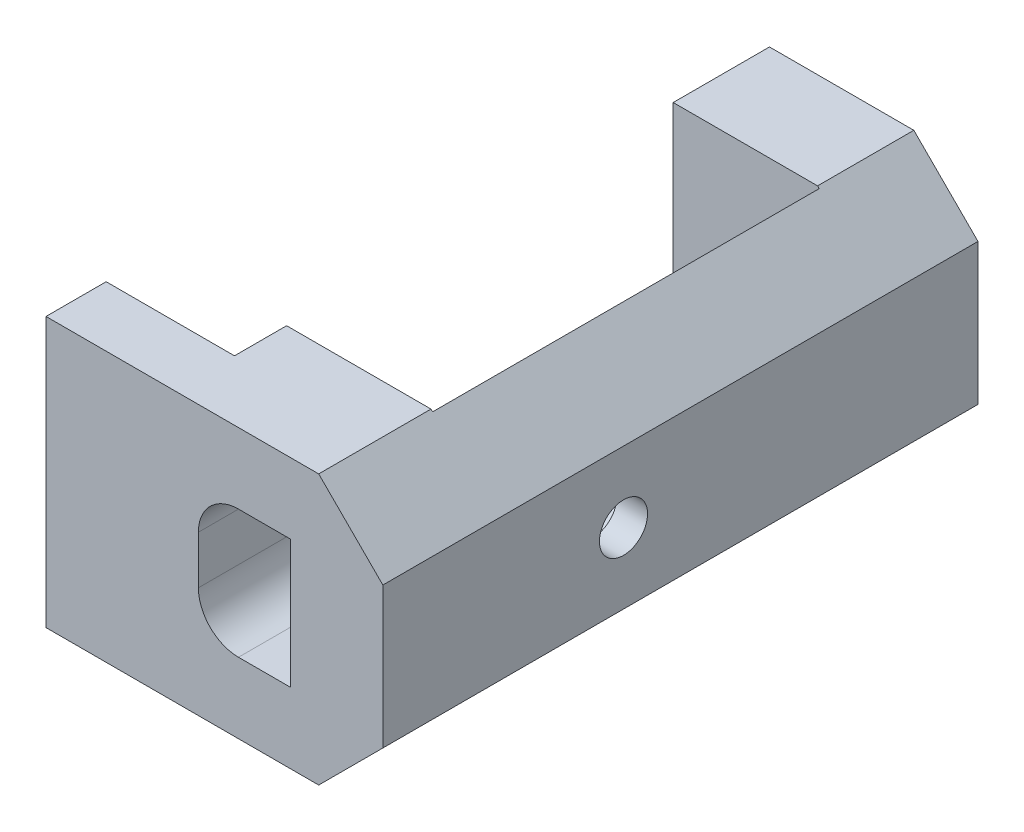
SolidWorks part; units mm, degrees
ref_plane "Front" through (0, 0, 0) normal (0, 0, 1) x (1, 0, 0)
ref_plane "Top" through (0, 0, 0) normal (0, 1, 0) x (1, 0, 0)
ref_plane "Right" through (0, 0, 0) normal (1, 0, 0) x (0, 0, -1)
sketch "Sketch1" plane through (0, 0, 0) normal (0, 1, 0) x (1, 0, 0)
  line L0 (0, 0) -> (13, 0)
  line L1 (13, 0) -> (13, 33.1)
  line L2 (0, 0) -> (0, 5)
  line L3 (0, 5) -> (9.1, 5)
  line L4 (9.1, 5) -> (9.1, 28.1)
  line L5 (13, 16.55) -> (-7.0543, 16.55) construction
  line L6 (0, 28.1) -> (9.1, 28.1)
  line L7 (0, 33.1) -> (0, 28.1)
  line L8 (0, 33.1) -> (13, 33.1)
  point P12 (9.1, 16.55)
  dimension "D1" = 5
  dimension "D2" = 13
  dimension "D3" = 9.1
  dimension "D4" = 16.55
extrude "Boss-Extrude1" add sketch "Sketch1" along normal blind 16.8
sketch "Sketch3" plane through (13, 0, 0) normal (1, 0, 0) x (0, 0, -1)
  line L0 (0, 8.4) -> (33.1, 8.4) construction
  line L1 (0, 16.8) -> (0, 0) construction
  line L2 (33.1, 16.8) -> (33.1, 0) construction
  circle A0 centre (12, 8.4) radius 1.5
  dimension "D1" = 3
  dimension "D2" = 12
extrude "Cut-Extrude2" cut sketch "Sketch3" against normal blind 10
sketch "Sketch5" plane through (9.1, 0, 0) normal (-1, 0, 0) x (0, 0, 1)
  line L1 (-11.9118, 11.3987) -> (-14.5528, 9.9758)
  line L2 (-14.5528, 9.9758) -> (-14.6411, 6.9771)
  line L3 (-14.6411, 6.9771) -> (-12.0882, 5.4013)
  line L4 (-12.0882, 5.4013) -> (-9.4472, 6.8242)
  line L5 (-9.4472, 6.8242) -> (-9.3589, 9.8229)
  line L6 (-9.3589, 9.8229) -> (-11.9118, 11.3987)
  circle A0 centre (-12, 8.4) radius 2.5981 construction
  dimension "D1" = 6
extrude "Cut-Extrude4" cut sketch "Sketch5" against normal blind 2
chamfer "Chamfer1" distance 4 angle 45 2 edges at (13, 16.8, -16.55) (13, 0, -16.55)
sketch "Sketch7" plane through (0, 0, 0) normal (0, 0, 1) x (1, 0, 0)
  line L0 (0, 0) -> (9, 0)
  line L1 (9, 0) -> (13, 4)
  line L2 (13, 4) -> (13, 12.8)
  line L3 (13, 12.8) -> (9, 16.8)
  line L4 (9, 16.8) -> (0, 16.8)
  line L5 (0, 16.8) -> (0, 0)
extrude "Boss-Extrude2" add sketch "Sketch7" along normal blind 3
sketch "Sketch6" plane through (0, 0, 0) normal (-1, 0, 0) x (0, 0, 1)
  line L0 (-5, 16.8) -> (3, 16.8) construction
  line L1 (-5, 0) -> (-0.75, 0)
  line L2 (-5, 0) -> (-5, 16.8)
  line L3 (-5, 16.8) -> (-0.75, 16.8)
  line L4 (-0.75, 0) -> (-0.75, 16.8)
  line L9 (-0.75, 0) -> (-0.75, 16.8)
  line L10 (-0.75, 16.8) -> (3, 16.8)
  line L11 (-0.75, 16.8) -> (-0.75, 0)
  line L12 (-0.75, 0) -> (3, 0)
  line L13 (3, 16.8) -> (3, 0)
  dimension "D1" = 4.25
extrude "Boss-Extrude3" add sketch "Sketch6" along normal blind 8 contours L4 M2 M15 M4
sketch "Sketch8" plane through (0, 0, 3) normal (0, 0, 1) x (1, 0, 0)
  line L0 (-8, 0) -> (9, 0) construction
  line L5 (7.25, 12.4) -> (7.25, 4.4)
  line L6 (7.25, 4.4) -> (4, 4.4)
  line L7 (1.5, 9.9) -> (1.5, 6.9)
  line L8 (7.25, 12.4) -> (4, 12.4)
  line L10 (13, 4) -> (13, 12.8) construction
  arc A0 (4, 12.4) -> (1.5, 9.9) centre (4, 9.9) ccw
  arc A1 (1.5, 6.9) -> (4, 4.4) centre (4, 6.9) ccw
  point P12 (1.5, 4.4)
  dimension "D5" = 2.5
  dimension "D1" = 8
  dimension "D2" = 4.4
  dimension "D3" = 5.75
  dimension "D4" = 5.75
extrude "Cut-Extrude7" cut sketch "Sketch8" against normal blind 8
sketch "Sketch10" plane through (0, 0, -33.1) normal (0, 0, -1) x (-1, 0, 0)
  line L0 (0, 16.8) -> (0, 0)
  line L1 (0, 0) -> (-9, 0)
  line L2 (-9, 0) -> (-13, 4)
  line L3 (-13, 4) -> (-13, 12.8)
  line L4 (-13, 12.8) -> (-9, 16.8)
  line L5 (-9, 16.8) -> (0, 16.8)
extrude "Boss-Extrude4" add sketch "Sketch10" along normal blind 1
sketch "Sketch11" plane through (0, 0, 0) normal (-1, 0, 0) x (0, 0, 1)
  circle A0 centre (-31.1, 8.4) radius 1
  dimension "D1" = 2
extrude "Cut-Extrude8" cut sketch "Sketch11" against normal blind 6
sketch "Sketch12" plane through (0, 0, -5) normal (0, 0, -1) x (-1, 0, 0)
  line L0 (0, 0) -> (0, 16.8)
  line L1 (0, 16.8) -> (-9, 16.8)
  line L2 (-9, 16.8) -> (-9.1, 16.7)
  line L3 (-9.1, 16.7) -> (-9.1, 0.1)
  line L4 (-9.1, 0.1) -> (-9, 0)
  line L5 (-9, 0) -> (0, 0)
extrude "Cut-Extrude9" cut sketch "Sketch12" against normal blind 1
